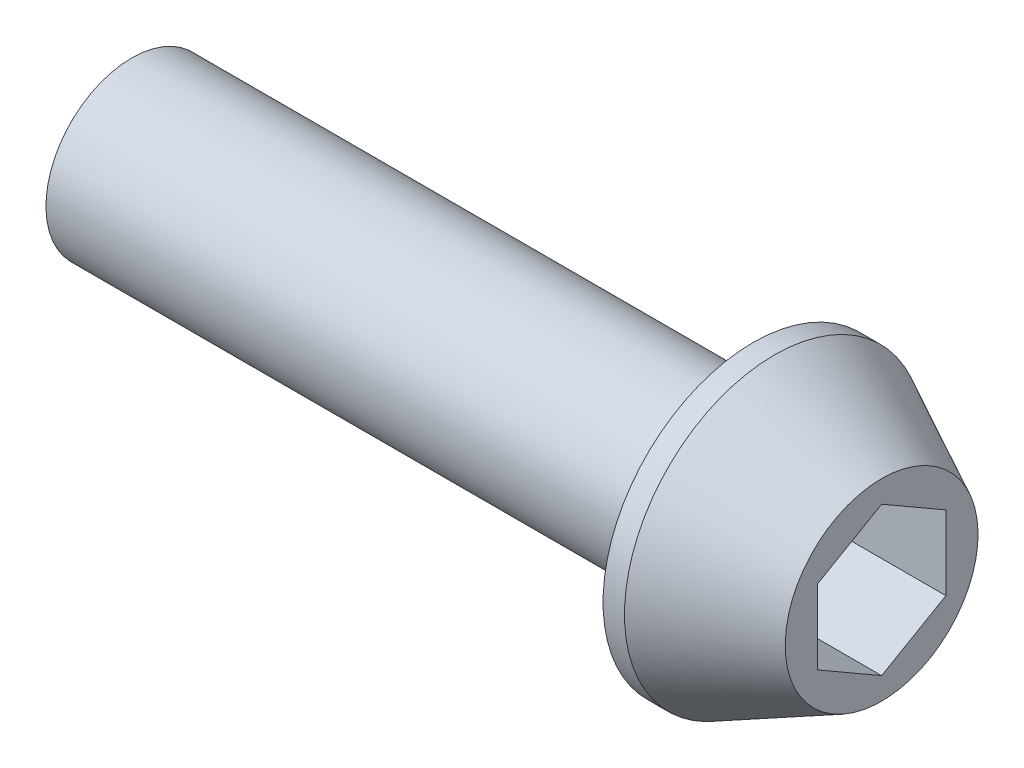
SolidWorks part; units mm, degrees
ref_plane "Alzado" through (0, 0, 0) normal (0, 0, 1) x (1, 0, 0)
ref_plane "Planta" through (0, 0, 0) normal (0, 1, 0) x (1, 0, 0)
ref_plane "Vista lateral" through (0, 0, 0) normal (1, 0, 0) x (0, 0, -1)
sketch "Croquis1" plane through (0, 0, 0) normal (0, 0, 1) x (1, 0, 0)
  line L0 (0, 0) -> (-35, 0) construction
  line L2 (0, 4.5) -> (0, 0)
  line L4 (-35, 4) -> (-35, 3)
  line L5 (-35, 0) -> (-35, 3) construction
  line L7 (-35, 4) -> (-6, 4)
  line L8 (-6, 4) -> (-6, 7)
  line L9 (-6, 7) -> (-5, 7)
  line L10 (-5, 7) -> (0, 4.5)
  line L11 (-35, 3) -> (-6, 3)
  line L12 (-6, 3) -> (-6, 0)
  line L13 (-6, 0) -> (0, 0)
  dimension "D1" = 35
  dimension "D2" = 1
  dimension "D3" = 4
  dimension "D4" = 7
  dimension "D5" = 6
  dimension "D6" = 1
  dimension "D7" = 4.5
revolve "Revolución1" add sketch "Croquis1" angle 360 about L0
sketch "Croquis2" plane through (0, 0, 0) normal (1, 0, 0) x (0, 0, -1)
  line L1 (0, 3.4641) -> (-3, 1.7321)
  line L2 (-3, 1.7321) -> (-3, -1.7321)
  line L3 (-3, -1.7321) -> (0, -3.4641)
  line L4 (0, -3.4641) -> (3, -1.7321)
  line L5 (3, -1.7321) -> (3, 1.7321)
  line L6 (3, 1.7321) -> (0, 3.4641)
  circle A0 centre (0, 0) radius 3 construction
  dimension "D1" = 6
extrude "Cortar-Extruir1" cut sketch "Croquis2" against normal blind 5
